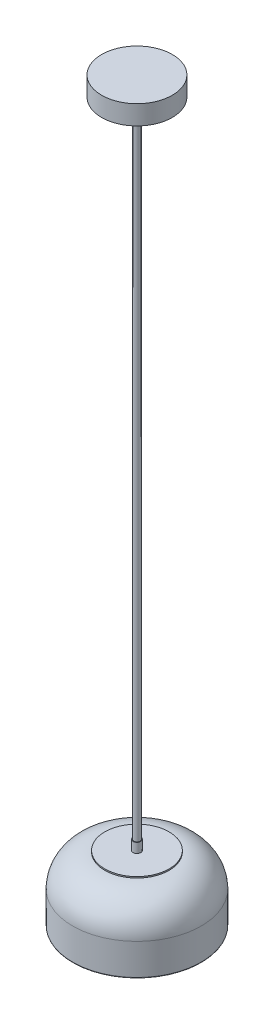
SolidWorks part; units mm, degrees
ref_plane "Alzado" through (0, 0, 0) normal (0, 0, 1) x (1, 0, 0)
ref_plane "Planta" through (0, 0, 0) normal (0, 1, 0) x (1, 0, 0)
ref_plane "Vista lateral" through (0, 0, 0) normal (1, 0, 0) x (0, 0, -1)
sketch "Croquis1" plane through (0, 0, 0) normal (0, 0, 1) x (1, 0, 0)
  line L0 (0, 30) -> (0, -70)
  line L1 (50, 30) -> (0, 30)
  line L2 (100, -20) -> (100, -70)
  line L3 (100, -70) -> (0, -70)
  line L5 (100, 30) -> (0, 0) construction
  line L6 (100, -70) -> (0, 0) construction
  arc A0 (50, 30) -> (100, -20) centre (50, -20) cw
  point P0 (0, 0)
  dimension "D3" = 50
  dimension "D1" = 100
  dimension "D2" = 100
revolve "Revolución1" add sketch "Croquis1" angle 360 about L0
shell "Vaciado1" thickness 3
fillet "Redondeo1" radius 1.5 2 edges at (-100, -70, 0) (-97, -70, 0)
sketch "Croquis2" plane through (0, 27, 0) normal (0, -1, 0) x (1, 0, 0)
  circle A0 centre (0, 0) radius 50
  dimension "D1" = 100
extrude "Saliente-Extruir1" add sketch "Croquis2" along normal blind 2 separate body
sketch "Croquis3" plane through (0, 25, 0) normal (0, -1, 0) x (1, 0, 0)
  circle A1 centre (0, 0) radius 50
  circle A2 centre (0, 0) radius 50
  dimension "D1" = 0
extrude "Saliente-Extruir2" add sketch "Croquis3" along normal blind 20 separate body
sketch "Croquis4" plane through (0, 5, 0) normal (0, -1, 0) x (1, 0, 0)
  circle A1 centre (0, 0) radius 50
  circle A2 centre (0, 0) radius 50
  dimension "D1" = 0
extrude "Saliente-Extruir3" add sketch "Croquis4" along normal blind 15 separate body
fillet "Redondeo2" radius 10 1 edges at (0, -10, -50)
sketch "Croquis5" plane through (0, 30, 0) normal (0, 1, 0) x (1, 0, 0)
  circle A0 centre (0, 0) radius 50
  dimension "D1" = 100
extrude "Saliente-Extruir4" add sketch "Croquis5" along normal blind 2 separate body
sketch "Croquis6" plane through (0, 32, 0) normal (0, 1, 0) x (1, 0, 0)
  circle A0 centre (0, 0) radius 6
  dimension "D1" = 12
extrude "Saliente-Extruir5" add sketch "Croquis6" along normal blind 15
sketch "Croquis7" plane through (0, 47, 0) normal (0, 1, 0) x (1, 0, 0)
  circle A0 centre (0, 0) radius 5
  dimension "D1" = 10
extrude "Saliente-Extruir6" add sketch "Croquis7" along normal blind 1000
sketch "Croquis8" plane through (0, 1047, 0) normal (0, 1, 0) x (1, 0, 0)
  circle A0 centre (0, 0) radius 54.991
  dimension "D1" = 109.982
extrude "Saliente-Extruir7" add sketch "Croquis8" along normal blind 30
